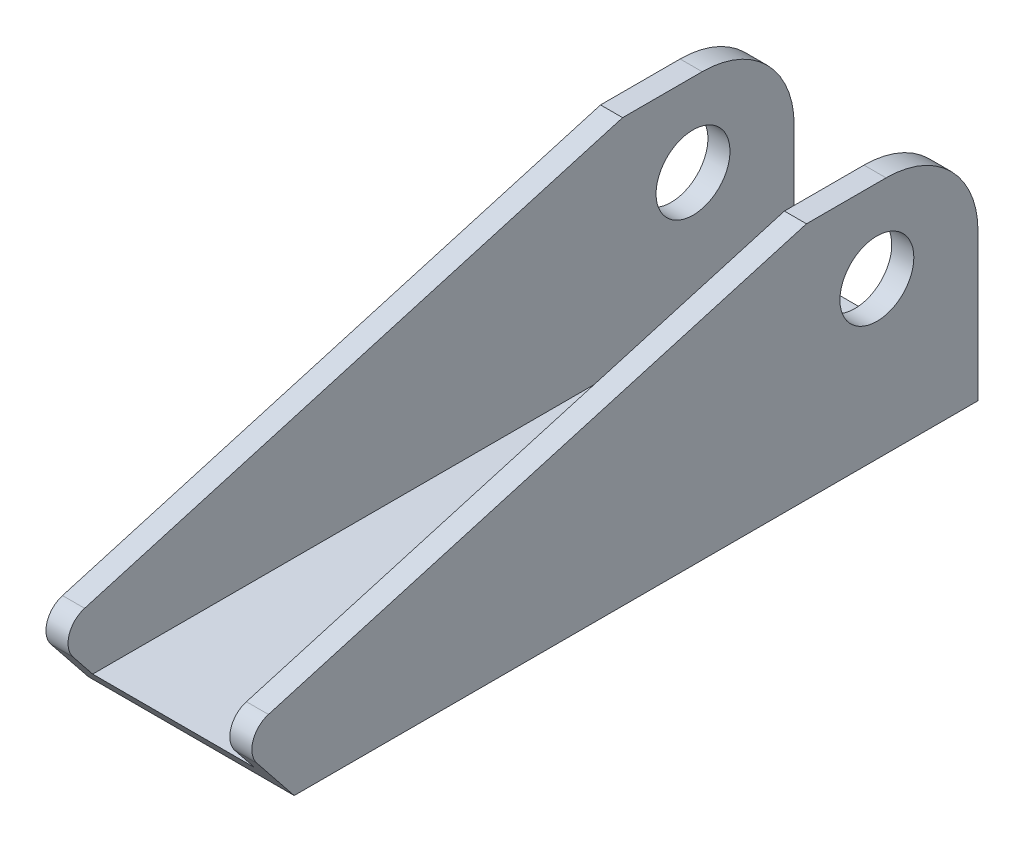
SolidWorks part; units mm, degrees
ref_plane "Front Plane" through (0, 0, 0) normal (0, 0, 1) x (1, 0, 0)
ref_plane "Top Plane" through (0, 0, 0) normal (0, 1, 0) x (1, 0, 0)
ref_plane "Right Plane" through (0, 0, 0) normal (1, 0, 0) x (0, 0, -1)
sketch "Sketch1" plane through (0, 0, 0) normal (0, 0, 1) x (1, 0, 0)
  line L0 (0, 16.51) -> (0, 0)
  line L1 (0, 0) -> (14.224, 0)
  line L2 (14.224, 0) -> (14.224, 16.51)
  line L3 (14.224, 16.51) -> (12.7, 16.51)
  line L4 (12.7, 16.51) -> (12.7, 1.524)
  line L5 (12.7, 1.524) -> (1.524, 1.524)
  line L6 (1.524, 1.524) -> (1.524, 16.51)
  line L7 (1.524, 16.51) -> (0, 16.51)
  dimension "D1" = 1.524
  dimension "D2" = 1.524
  dimension "D3" = 1.524
  dimension "D4" = 11.176
  dimension "D5" = 16.51
  dimension "D6" = 16.51
extrude "Extrude1" add sketch "Sketch1" along normal blind 57.15
hole_wizard "#10 Clearance Hole1" positions "3DSketch1" profile "Sketch2" hole size "#10" standard "Ansi Inch"
sketch3d "3DSketch1"
  line L0 (0, 16.51, 0) -> (0, 0, 0) construction
  line L1 (0, 16.51, 57.15) -> (0, 16.51, 0) construction
  point P0 (0, 10.795, 6.985)
  dimension "D1" = 6.985
  dimension "D2" = 5.715
sketch "Sketch2" plane through (0, 10.795, 6.985) normal (0, 1, 0) x (0, 0, 1)
  line L0 (0, 0) -> (0, 26.9338)
  line L1 (0, 26.9338) -> (2.5527, 25.4)
  line L2 (2.5527, 25.4) -> (2.5527, 0)
  line L5 (2.5527, 0) -> (0, 0)
  line L10 (0, 26.9338) -> (-2.5527, 25.4) construction
  line L11 (0, -6.35) -> (0, 107.95) construction
  dimension "Hole Dia." = 5.1054
  dimension "Hole Depth" = 25.4
  dimension "Drill Angle" = 118
fillet "Fillet1" radius 6.35 2 edges at (13.462, 16.51, 0) (0.762, 16.51, 0)
sketch "Sketch3" plane through (0, 0, 0) normal (-1, 0, 0) x (0, 0, 1)
  line L0 (38.1, 16.51) -> (57.15, 0)
  line L1 (57.15, 16.51) -> (6.35, 16.51) construction
  line L2 (0, 10.16) -> (0, 0) construction
  line L3 (38.1, 16.51) -> (57.15, 16.51)
  line L4 (57.15, 16.51) -> (57.15, 0)
  dimension "D1" = 38.1
extrude "Cut-Extrude1" cut sketch "Sketch3" against normal through all
sketch "Sketch4" plane through (0, 0, 0) normal (-1, 0, 0) x (0, 0, 1)
  line L0 (51.2885, 5.08) -> (47.2313, 0)
  line L1 (38.1, 16.51) -> (57.15, 0) construction
  line L2 (57.15, 0) -> (0, 0) construction
  line L3 (51.2885, 5.08) -> (57.15, 0)
  line L4 (57.15, 0) -> (47.2313, 0)
  dimension "D1" = 5.08
extrude "Cut-Extrude2" cut sketch "Sketch4" against normal through all
sketch "Sketch5" plane through (0, 0, 0) normal (-1, 0, 0) x (0, 0, 1)
  line L0 (51.2885, 5.08) -> (11.8476, 16.51)
  line L3 (38.1, 16.51) -> (6.35, 16.51) construction
  line L4 (38.1, 16.51) -> (51.2885, 5.08)
  line L5 (11.8476, 16.51) -> (38.1, 16.51)
extrude "Cut-Extrude3" cut sketch "Sketch5" against normal through all
fillet "Fillet4" radius 1.5875 2 edges at (0.762, 5.08, 51.2885) (13.462, 5.08, 51.2885)
